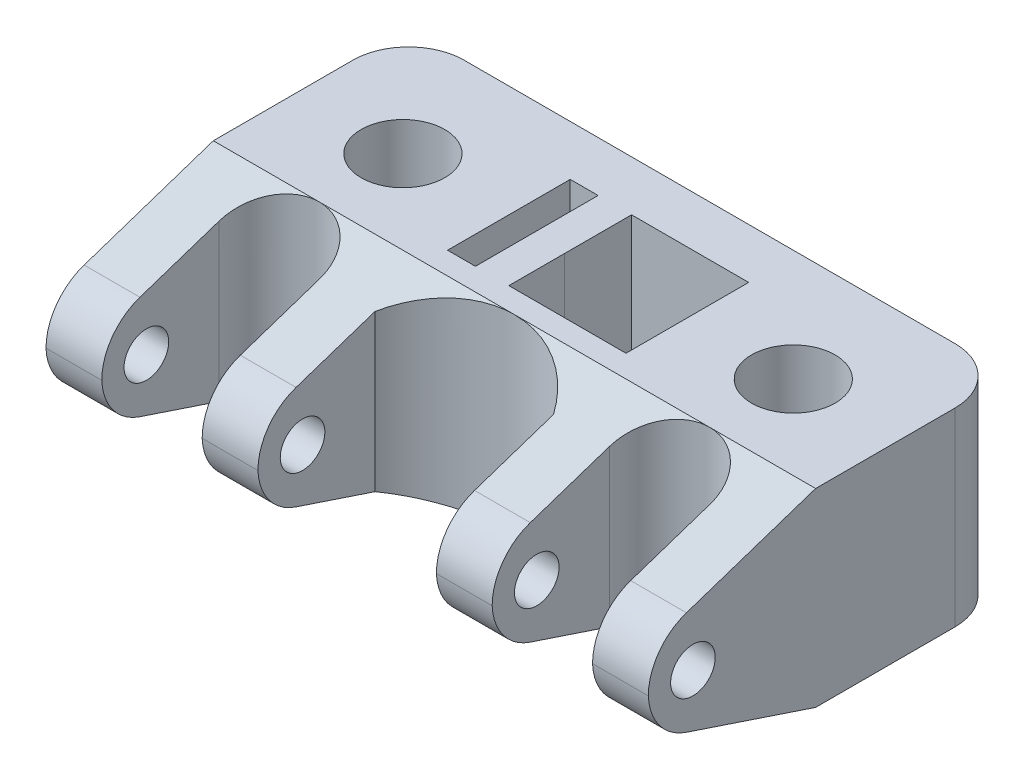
SolidWorks part; units mm, degrees
ref_plane "Ebene vorne" through (0, 0, 0) normal (0, 0, 1) x (1, 0, 0)
ref_plane "Ebene oben" through (0, 0, 0) normal (0, 1, 0) x (1, 0, 0)
ref_plane "Ebene rechts" through (0, 0, 0) normal (1, 0, 0) x (0, 0, -1)
sketch "Skizze1" plane through (0, 0, 0) normal (0, 1, 0) x (1, 0, 0)
  line L0 (55.0044, -15) -> (-44.9956, -15)
  line L1 (-44.9956, -15) -> (-44.9956, 15)
  line L2 (-44.9956, 15) -> (55.0044, 15)
  line L3 (55.0044, 15) -> (55.0044, -15)
  point P5 (55.0044, -15)
  dimension "D1" = 30
  dimension "D2" = 100
extrude "Aufsatz-Linear austragen2" add sketch "Skizze1" along normal blind 34
sketch "Skizze5" plane through (0, 34, 0) normal (0, 1, 0) x (1, 0, 0)
  circle A0 centre (-29.9956, 0) radius 7.5
  circle A1 centre (40.0044, 0) radius 7.5
  dimension "D1" = 70
sketch "Skizze6" plane through (0, 34, 0) normal (0, 1, 0) x (1, 0, 0)
  line L2 (21.0044, 0) -> (21.0044, 11)
  line L3 (21.0044, 11) -> (-10.9956, 11)
  line L4 (-10.9956, 11) -> (-10.9956, -11)
  line L5 (-10.9956, -11) -> (21.0044, -11)
  line L6 (21.0044, -11) -> (21.0044, 0)
  dimension "D3" = 11
  dimension "D4" = 22
extrude "Schnitt-Linear austragen3" cut sketch "Skizze6" against normal blind 34
extrude "Schnitt-Linear austragen4" cut sketch "Skizze5" against normal blind 24
sketch "Skizze8" plane through (0, 0, -15) normal (0, 0, -1) x (-1, 0, 0)
  line L1 (-55.0044, 34) -> (44.9956, 34)
  line L2 (-55.0044, 34) -> (-55.0044, 0)
  line L3 (-55.0044, 0) -> (44.9956, 0)
  line L4 (44.9956, 34) -> (44.9956, 0)
extrude "Aufsatz-Linear austragen3" add sketch "Skizze8" along normal blind 5
sketch "Skizze9" plane through (0, 34, 0) normal (0, 1, 0) x (1, 0, 0)
  line L0 (45.0044, -15) -> (35.0044, -15)
  line L1 (-44.9956, -15) -> (55.0044, -15) construction
  line L2 (55.0044, -15) -> (45.0044, -15)
  line L3 (-44.9956, -15) -> (-34.9956, -15)
  line L4 (-44.9956, -15) -> (-44.9956, -45)
  line L5 (-44.9956, -45) -> (-34.9956, -45)
  line L6 (-34.9956, -15) -> (-34.9956, -45)
  line L7 (55.0044, -15) -> (55.0044, -45)
  line L8 (-24.9956, -15) -> (-14.9956, -15)
  line L9 (-24.9956, -15) -> (-24.9956, -45)
  line L10 (-24.9956, -45) -> (-14.9956, -45)
  line L11 (-14.9956, -15) -> (-14.9956, -45)
  line L12 (55.0044, -45) -> (45.0044, -45)
  line L13 (45.0044, -15) -> (45.0044, -45)
  line L15 (35.0044, -15) -> (25.0044, -15)
  line L16 (35.0044, -15) -> (35.0044, -45)
  line L17 (35.0044, -45) -> (25.0044, -45)
  line L18 (25.0044, -15) -> (25.0044, -45)
  dimension "D1" = 10
  dimension "D2" = 10
  dimension "D3" = 30
  dimension "D4" = 30
  dimension "D5" = 30
  dimension "D6" = 10
  dimension "D7" = 10
  dimension "D8" = 10
  dimension "D9" = 30
extrude "Aufsatz-Linear austragen4" add sketch "Skizze9" against normal blind 34 contours L11 L9 L10 M12 | L18 L17 L16 M12 | L13 L12 L7 M12 | L6 L5 L4 L3
sketch "Skizze12" plane through (0, 0, 45) normal (0, 0, 1) x (1, 0, 0)
  line L0 (-24.9956, 0) -> (-14.9956, 0) construction
  line L1 (-34.9956, 34) -> (-38.9956, 34)
  line L2 (-34.9956, 34) -> (-34.9956, 0)
  line L3 (-34.9956, 0) -> (-38.9956, 0)
  line L4 (-38.9956, 34) -> (-38.9956, 0)
  line L5 (-24.9956, 34) -> (-20.9956, 34)
  line L6 (-24.9956, 34) -> (-24.9956, 0)
  line L7 (-24.9956, 0) -> (-20.9956, 0)
  line L8 (-20.9956, 34) -> (-20.9956, 0)
  line L9 (35.0044, 0) -> (25.0044, 0) construction
  line L10 (35.0044, 34) -> (31.0044, 34)
  line L11 (35.0044, 34) -> (35.0044, 0)
  line L12 (35.0044, 0) -> (31.0044, 0)
  line L13 (31.0044, 34) -> (31.0044, 0)
  line L14 (55.0044, 0) -> (45.0044, 0) construction
  line L15 (45.0044, 34) -> (49.0044, 34)
  line L16 (45.0044, 34) -> (45.0044, 0)
  line L17 (45.0044, 0) -> (49.0044, 0)
  line L18 (49.0044, 34) -> (49.0044, 0)
  dimension "D1" = 4
  dimension "D2" = 4
  dimension "D3" = 4
  dimension "D4" = 4
extrude "Schnitt-Linear austragen5" cut sketch "Skizze12" against normal blind 30
sketch "Skizze13" plane through (0, 0, 45) normal (0, 0, 1) x (1, 0, 0)
  line L1 (-44.9956, 34) -> (-48.9956, 34)
  line L2 (-44.9956, 34) -> (-44.9956, 0)
  line L3 (-44.9956, 0) -> (-48.9956, 0)
  line L4 (-48.9956, 34) -> (-48.9956, 0)
  line L5 (-14.9956, 34) -> (-10.9956, 34)
  line L6 (-14.9956, 34) -> (-14.9956, 0)
  line L7 (-14.9956, 0) -> (-10.9956, 0)
  line L8 (-10.9956, 34) -> (-10.9956, 0)
  line L9 (25.0044, 34) -> (21.0044, 34)
  line L10 (25.0044, 34) -> (25.0044, 0)
  line L11 (25.0044, 0) -> (21.0044, 0)
  line L12 (21.0044, 34) -> (21.0044, 0)
  line L13 (55.0044, 34) -> (59.0044, 34)
  line L14 (55.0044, 34) -> (55.0044, 0)
  line L15 (55.0044, 0) -> (59.0044, 0)
  line L16 (59.0044, 34) -> (59.0044, 0)
  dimension "D1" = 4
  dimension "D2" = 4
  dimension "D3" = 4
  dimension "D4" = 4
extrude "Aufsatz-Linear austragen5" add sketch "Skizze13" against normal blind 65
sketch "Skizze15" plane through (0, 34, 0) normal (0, 1, 0) x (1, 0, 0)
  line L0 (-20.9956, -15) -> (-20.9956, -24)
  line L1 (-20.9956, -15) -> (-20.9956, -45) construction
  line L2 (21.0044, -15) -> (21.0044, -24)
  line L3 (-38.9956, -15) -> (-38.9956, -45) construction
  line L4 (-38.9956, -24) -> (-38.9956, -15)
  line L5 (-38.9956, -15) -> (-20.9956, -15)
  line L6 (21.0044, -15) -> (21.0044, -45) construction
  line L7 (21.0044, -15) -> (-10.9956, -15)
  line L8 (-10.9956, -15) -> (-10.9956, -24)
  line L9 (-10.9956, -15) -> (-10.9956, -45) construction
  line L10 (31.0044, -24) -> (31.0044, -15)
  line L11 (31.0044, -15) -> (31.0044, -45) construction
  line L12 (31.0044, -15) -> (49.0044, -15)
  line L13 (49.0044, -15) -> (49.0044, -24)
  line L14 (49.0044, -15) -> (49.0044, -45) construction
  arc A0 (-20.9956, -24) -> (-38.9956, -24) centre (-29.9956, -24) ccw
  arc A1 (-10.9956, -24) -> (21.0044, -24) centre (5.0044, -33.7222) cw
  arc A2 (49.0044, -24) -> (31.0044, -24) centre (40.0044, -24) ccw
  dimension "D1" = 9
extrude "Aufsatz-Linear austragen7" add sketch "Skizze15" against normal blind 34 contours A0 M17 M16 | A0 L5 M18 | L7 A1 M6 | A1 M20 M5 | A2 M9 M8 | A2 L12 M10
sketch "Skizze16" plane through (-48.9956, 0, 0) normal (-1, 0, 0) x (0, 0, 1)
  line L0 (45, 34) -> (45, 24)
  line L1 (45, 34) -> (45, 0) construction
  line L2 (45, 0) -> (45, 10)
  line L3 (45, 0) -> (15, 0)
  line L4 (-20, 0) -> (45, 0) construction
  line L5 (15, 0) -> (45, 10)
  line L6 (45, 24) -> (15, 34)
  line L7 (-20, 34) -> (45, 34) construction
  line L8 (15, 34) -> (45, 34)
  dimension "D1" = 10
  dimension "D2" = 10
  dimension "D3" = 30
extrude "Schnitt-Linear austragen6" cut sketch "Skizze16" against normal blind 108
fillet "Verrundung11" radius 10 1 edges at (-43.9956, 24, 45)
fillet "Verrundung12" radius 10 1 edges at (-43.9956, 10, 45)
fillet "Verrundung13" radius 10 1 edges at (-15.9956, 24, 45)
fillet "Verrundung14" radius 10 1 edges at (-15.9956, 10, 45)
fillet "Verrundung15" radius 10 1 edges at (26.0044, 24, 45)
fillet "Verrundung16" radius 10 1 edges at (26.0044, 10, 45)
fillet "Verrundung17" radius 10 1 edges at (54.0044, 24, 45)
fillet "Verrundung18" radius 10 1 edges at (54.0044, 10, 45)
sketch "Skizze18" plane through (-48.9956, 0, 0) normal (-1, 0, 0) x (0, 0, 1)
  circle A0 centre (37, 16.7924) radius 4
extrude "Schnitt-Linear austragen7" cut sketch "Skizze18" against normal blind 108
fillet "Verrundung19" radius 10 1 edges at (-48.9956, 17, -20)
fillet "Verrundung20" radius 10 1 edges at (59.0044, 17, -20)
sketch "Skizze19" plane through (0, 10, 0) normal (0, 1, 0) x (1, 0, 0)
  circle A0 centre (-29.9956, 0) radius 4.25
  circle A1 centre (40.0044, 0) radius 4.25
extrude "Schnitt-Linear austragen8" cut sketch "Skizze19" against normal blind 10
sketch "Skizze20" plane through (0, 34, 0) normal (0, 1, 0) x (1, 0, 0)
  line L0 (-5.9956, 11) -> (0.0044, 11)
  line L1 (21.0044, 11) -> (-10.9956, 11) construction
  line L2 (-5.9956, 11) -> (-5.9956, -1)
  line L3 (0, -1) -> (0, -11)
  line L4 (0, -1) -> (0.0044, 11)
  line L5 (-10.9956, -11) -> (21.0044, -11) construction
  line L6 (0, -11) -> (-5.9956, -11)
  line L7 (-5.9956, -11) -> (-5.9956, -1)
  dimension "D1" = 6
  dimension "D2" = 12
extrude "Aufsatz-Linear austragen8" add sketch "Skizze20" against normal blind 34
